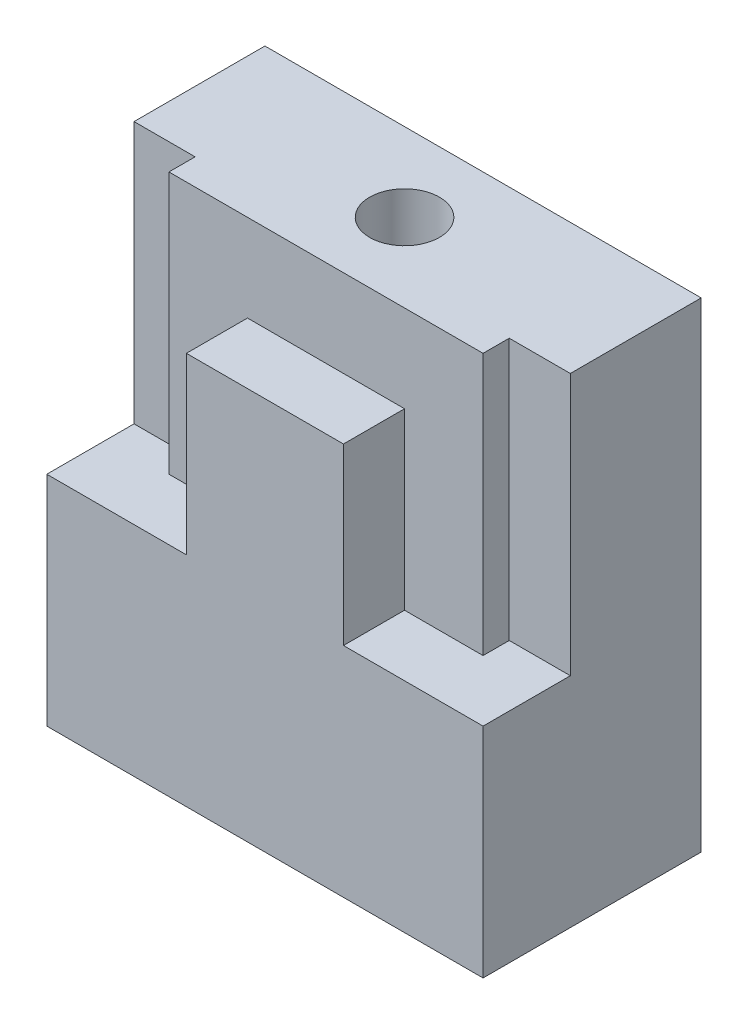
SolidWorks part; units mm, degrees
ref_plane "前视基准面" through (0, 0, 0) normal (0, 0, 1) x (1, 0, 0)
ref_plane "上视基准面" through (0, 0, 0) normal (0, 1, 0) x (1, 0, 0)
ref_plane "右视基准面" through (0, 0, 0) normal (1, 0, 0) x (0, 0, -1)
sketch "草图1" plane through (0, 0, 0) normal (0, 1, 0) x (1, 0, 0)
  line L0 (0, 0) -> (80.8939, 0) construction
  line L1 (80.8939, 0) -> (0, 0) construction
  line L2 (0, 0) -> (0, 69.8629) construction
  line L4 (-25, 12.5) -> (25, 12.5)
  line L5 (-25, 12.5) -> (-25, -12.5)
  line L6 (-25, -12.5) -> (25, -12.5)
  line L7 (25, 12.5) -> (25, -12.5)
extrude "拉伸1" add sketch "草图1" along normal blind 55
sketch "草图2" plane through (0, 55, 0) normal (0, 1, 0) x (1, 0, 0)
  line L0 (-25, -12.5) -> (25, -12.5) construction
  circle A0 centre (0, 3.5) radius 4
  dimension "D1" = 16
extrude "切除-拉伸1" cut sketch "草图2" against normal blind 55
sketch "草图3" plane through (0, 55, 0) normal (0, 1, 0) x (1, 0, 0)
  line L0 (0, 0) -> (0, -17.4808) construction
  line L1 (-25, -12.5) -> (25, -12.5) construction
  line L2 (-9, -5.5) -> (9, -5.5)
  line L3 (-9, -5.5) -> (-9, -12.5)
  line L4 (-9, -12.5) -> (9, -12.5)
  line L5 (9, -5.5) -> (9, -12.5)
extrude "切除-拉伸2" cut sketch "草图3" against normal blind 10
sketch "草图4" plane through (0, 55, 0) normal (0, 1, 0) x (1, 0, 0)
  line L0 (-9, -5.5) -> (-18, -5.5)
  line L2 (-18, -5.5) -> (-18, -2.5)
  line L3 (-18, -2.5) -> (-25, -2.5)
  line L4 (-25, 12.5) -> (-25, -12.5) construction
  line L5 (-25, -2.5) -> (-25, -12.5)
  line L6 (-25, -12.5) -> (-9, -12.5)
  line L7 (-9, -12.5) -> (-9, -5.5)
  line L8 (0, 0) -> (0, -17.9598) construction
  line L9 (9, -12.5) -> (9, -5.5)
  line L10 (25, -12.5) -> (9, -12.5)
  line L11 (25, -2.5) -> (25, -12.5)
  line L12 (18, -2.5) -> (25, -2.5)
  line L13 (18, -5.5) -> (18, -2.5)
  line L14 (9, -5.5) -> (18, -5.5)
extrude "切除-拉伸3" cut sketch "草图4" against normal blind 30
